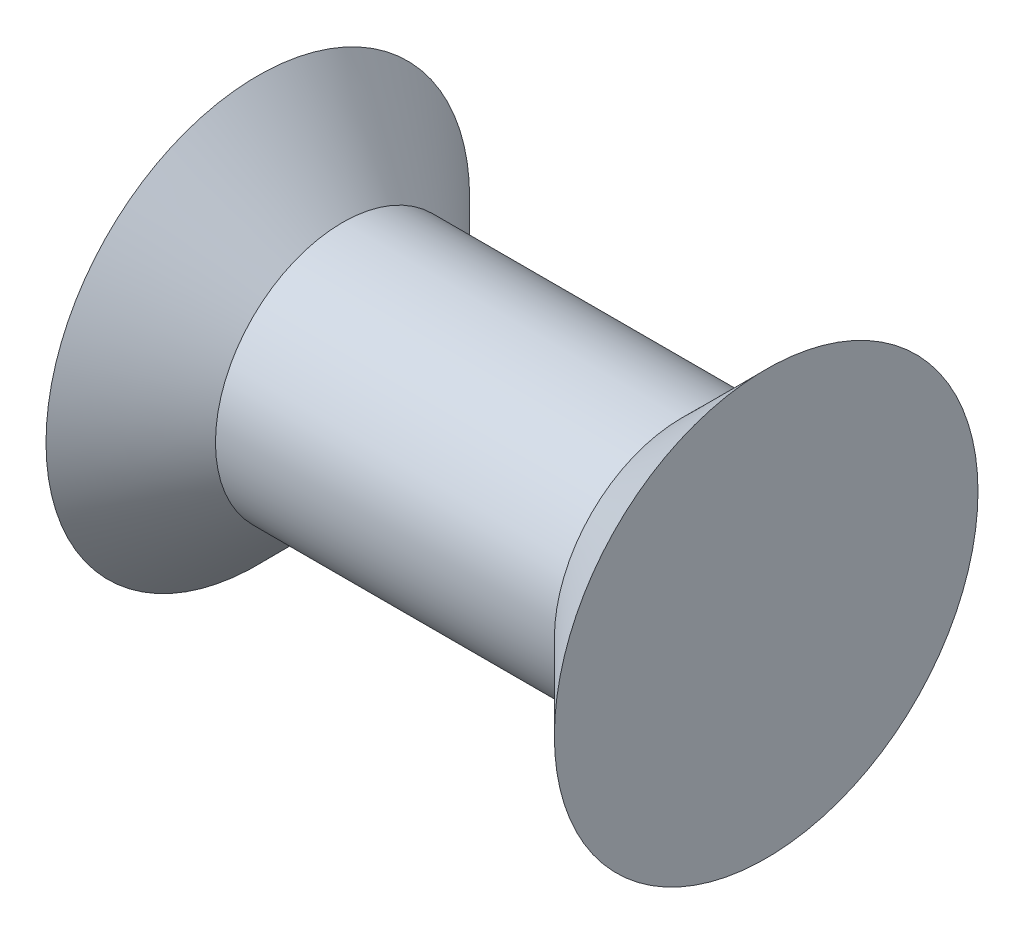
SolidWorks part; units mm, degrees
ref_plane "Plan de face" through (0, 0, 0) normal (0, 0, 1) x (1, 0, 0)
ref_plane "Plan de dessus" through (0, 0, 0) normal (0, 1, 0) x (1, 0, 0)
ref_plane "Plan de droite" through (0, 0, 0) normal (1, 0, 0) x (0, 0, -1)
sketch "Esquisse1" plane through (0, 0, 0) normal (0, 0, 1) x (1, 0, 0)
  line L0 (-15.3509, 37.5536) -> (32.282, 37.5536) construction
  line L1 (-6.1269, 40.5536) -> (1.8731, 40.5536)
  line L2 (1.8731, 40.5536) -> (3.8731, 42.5536)
  line L3 (3.8731, 42.5536) -> (3.8731, 37.5536)
  line L4 (-6.1269, 40.5536) -> (-8.1269, 42.5536)
  line L5 (-8.1269, 42.5536) -> (-8.1269, 37.5536)
  line L6 (3.8731, 37.5536) -> (-8.1269, 37.5536)
  dimension "D1" = 6
  dimension "D2" = 8
  dimension "D3" = 45
  dimension "D4" = 10
  dimension "D5" = 10
revolve "Révolution1" add sketch "Esquisse1" angle 360 about L0
